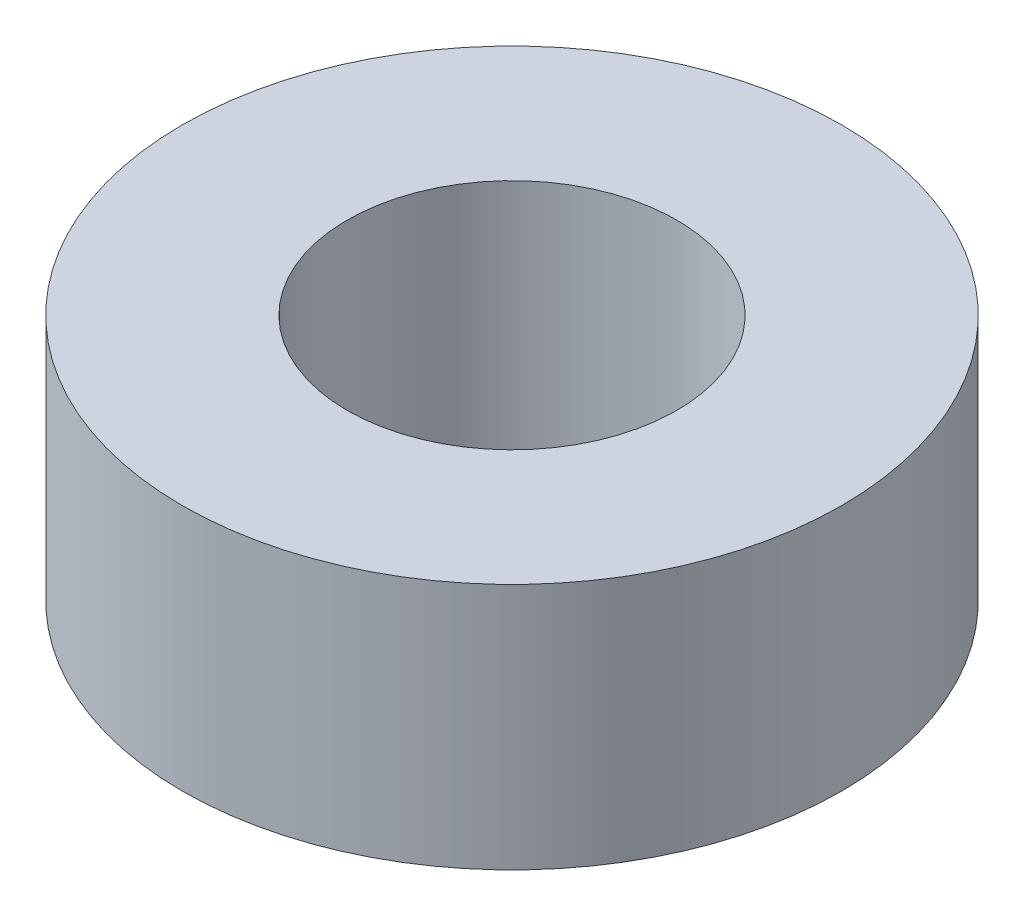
SolidWorks part; units mm, degrees
ref_plane "Front" through (0, 0, 0) normal (0, 0, 1) x (1, 0, 0)
ref_plane "Top" through (0, 0, 0) normal (0, 1, 0) x (1, 0, 0)
ref_plane "Right" through (0, 0, 0) normal (1, 0, 0) x (0, 0, -1)
sketch "Sketch1" plane through (0, 0, 0) normal (0, 0, 1) x (1, 0, 0)
  line L0 (0, 9.2238) -> (0, -11.9322) construction
  line L1 (2, 0) -> (4, 0)
  line L2 (2, 0) -> (2, 3)
  line L3 (2, 3) -> (4, 3)
  line L4 (4, 0) -> (4, 3)
  dimension "D1" = 3
  dimension "D2" = 2
  dimension "D3" = 2
  dimension "D4" = 2
revolve "Revolve1" add sketch "Sketch1" angle 360 about L0
